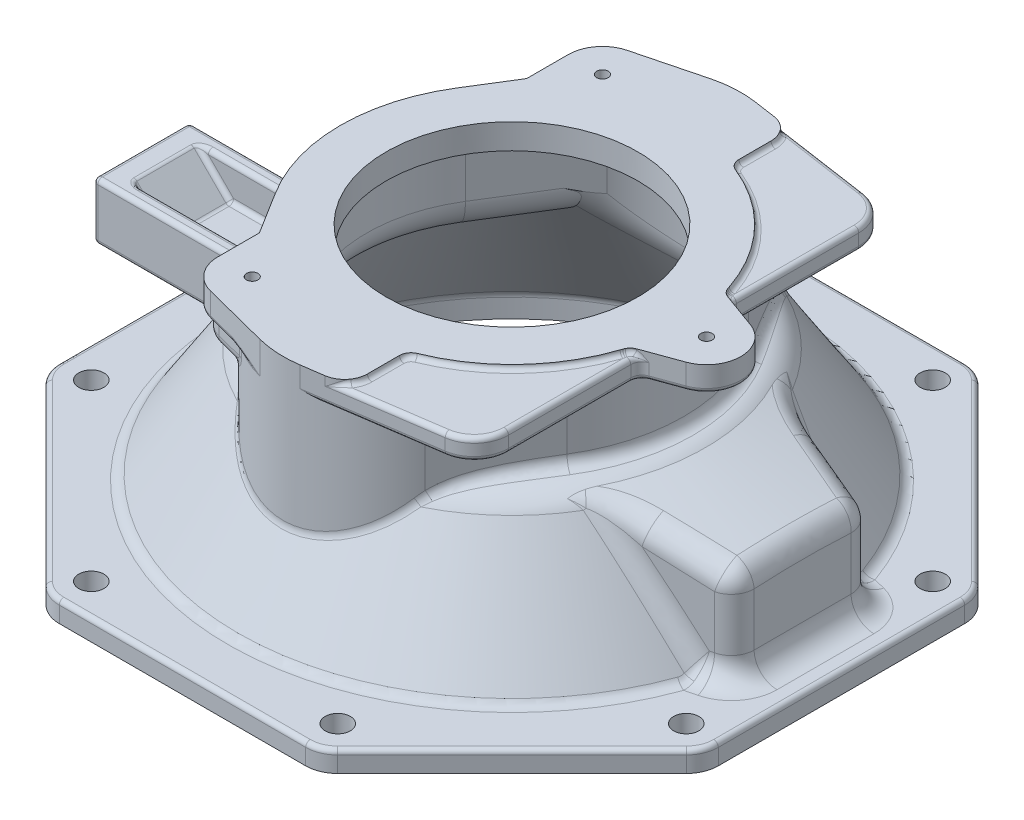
SolidWorks part; units mm, degrees
ref_plane "Plan de face" through (0, 0, 0) normal (0, 0, 1) x (1, 0, 0)
ref_plane "Plan de dessus" through (0, 0, 0) normal (0, 1, 0) x (1, 0, 0)
ref_plane "Plan de droite" through (0, 0, 0) normal (1, 0, 0) x (0, 0, -1)
sketch "Esquisse1" plane through (0, 0, 0) normal (0, 0, 1) x (1, 0, 0)
  line L0 (0, 71.5) -> (0, 81.5)
  line L1 (0, 81.5) -> (85, 81.5)
  line L2 (85, 81.5) -> (129, 12.5)
  line L3 (129, 12.5) -> (129, 0)
  line L4 (129, 0) -> (117, 0)
  line L5 (117, 0) -> (117, 12.7193)
  line L6 (117, 12.7193) -> (79.5166, 71.5)
  line L7 (79.5166, 71.5) -> (0, 71.5)
  dimension "D1" = 81.5
  dimension "D2" = 10
  dimension "D3" = 10
  dimension "D4" = 129
  dimension "D5" = 117
  dimension "D6" = 12.5
  dimension "D7" = 85
revolve "Révolution1" add sketch "Esquisse1" angle 360 about L0
ref_plane "Plan1" through (0, 12.5, 0) normal (0, -1, 0) x (1, 0, 0)
sketch "Esquisse2" plane through (0, 12.5, 0) normal (0, -1, 0) x (1, 0, 0)
  line L0 (-59.6468, 144) -> (59.6468, 144)
  line L1 (-59.6468, -144) -> (59.6468, -144)
  line L2 (144, 59.6468) -> (144, -59.6468)
  line L3 (-144, 59.6468) -> (-144, -59.6468)
  line L4 (-59.6468, 144) -> (-144, 59.6468)
  line L5 (-144, -59.6468) -> (-59.6468, -144)
  line L6 (59.6468, -144) -> (144, -59.6468)
  line L7 (59.6468, 144) -> (144, 59.6468)
  circle A0 centre (0, 0) radius 144 construction
  circle A2 centre (0, 0) radius 117 construction
  circle A3 centre (0, 0) radius 117
  dimension "D1" = 288
  dimension "D2" = 45
  dimension "D3" = 45
  dimension "D4" = 45
  dimension "D5" = 45
extrude "Boss.-Extru.1" add sketch "Esquisse2" against normal blind 12
sketch "Esquisse3" plane through (0, 81.5, 0) normal (0, 1, 0) x (1, 0, 0)
  line L0 (0, 0) -> (48.7796, 0) construction
  line L1 (39.9057, 77.8302) -> (63.6792, 39.6226)
  line L2 (39.9057, -77.8302) -> (63.6792, -39.6226)
  line L3 (0, 0) -> (0, 29.6462) construction
  line L4 (-39.9057, 77.8302) -> (-63.6792, 39.6226)
  line L5 (-39.9057, -77.8302) -> (-63.6792, -39.6226)
  arc A0 (-63.6792, 39.6226) -> (-63.6792, -39.6226) centre (0, 0) ccw
  arc A1 (39.9057, 77.8302) -> (-39.9057, 77.8302) centre (0, 53) ccw
  arc A2 (39.9057, -77.8302) -> (-39.9057, -77.8302) centre (0, -53) cw
  arc A3 (63.6792, -39.6226) -> (63.6792, 39.6226) centre (0, 0) ccw
  dimension "D1" = 150
  dimension "D2" = 94
  dimension "D3" = 53
extrude "Boss.-Extru.2" add sketch "Esquisse3" along normal blind 29 and the other way up to next
sketch "Esquisse6" plane through (0, 71.5, 0) normal (0, -1, 0) x (1, 0, 0)
  line L16 (32.783, 67.5094) -> (30.1415, 71.7547)
  line L17 (53.9151, 33.5472) -> (32.783, 67.5094)
  line L18 (32.783, -67.5094) -> (53.9151, -33.5472)
  line L19 (30.1415, -71.7547) -> (32.783, -67.5094)
  line L20 (-32.783, -67.5094) -> (-30.1415, -71.7547)
  line L21 (-53.9151, -33.5472) -> (-32.783, -67.5094)
  line L22 (-32.783, 67.5094) -> (-53.9151, 33.5472)
  line L23 (-30.1415, 71.7547) -> (-32.783, 67.5094)
  line L24 (32.783, 67.5094) -> (30.1415, 71.7547)
  line L25 (53.9151, 33.5472) -> (32.783, 67.5094)
  line L26 (32.783, -67.5094) -> (53.9151, -33.5472)
  line L27 (30.1415, -71.7547) -> (32.783, -67.5094)
  line L28 (-32.783, -67.5094) -> (-30.1415, -71.7547)
  line L29 (-53.9151, -33.5472) -> (-32.783, -67.5094)
  line L30 (-32.783, 67.5094) -> (-53.9151, 33.5472)
  line L31 (-30.1415, 71.7547) -> (-32.783, 67.5094)
  arc A8 (53.9151, -33.5472) -> (53.9151, 33.5472) centre (0, 0) ccw
  arc A9 (-30.1415, -71.7547) -> (30.1415, -71.7547) centre (0, -53) ccw
  arc A10 (-53.9151, 33.5472) -> (-53.9151, -33.5472) centre (0, 0) ccw
  arc A11 (30.1415, 71.7547) -> (-30.1415, 71.7547) centre (0, 53) ccw
  arc A12 (53.9151, -33.5472) -> (53.9151, 33.5472) centre (0, 0) ccw
  arc A13 (-30.1415, -71.7547) -> (30.1415, -71.7547) centre (0, -53) ccw
  arc A14 (-53.9151, 33.5472) -> (-53.9151, -33.5472) centre (0, 0) ccw
  arc A15 (30.1415, 71.7547) -> (-30.1415, 71.7547) centre (0, 53) ccw
  dimension "D1" = 11.5
extrude "Enlèv. mat.-Extru.1" cut sketch "Esquisse6" against normal blind 39 and the other way up to next
fillet "Congé2" radius 15 2 edges
fillet "Congé9" radius 5 12 edges at (3.7957, 58.1049, 99.8465) (-44.2153, 79.8774, 70.904) (-45.2998, 80.2905, -69.161) (-3.7957, 58.1049, -99.8465) (44.2153, 79.8774, -70.904) (59.3437, 81.5, -46.5905) (45.2998, 80.2905, 69.161)
fillet "Congé10" radius 5 1 edges at (0, 24.5, -121.3478)
fillet "Congé11" radius 14 8 edges at (-144, 18.5, 59.6468) (-144, 18.5, -59.6468) (-59.6468, 18.5, -144) (59.6468, 18.5, -144) (144, 18.5, -59.6468) (-59.6468, 18.5, 144) (59.6468, 18.5, 144) (144, 18.5, 59.6468)
fillet "Congé6" radius 15 8 edges at (42.0283, 71.5, -52.6509) (-1.42, 57.4391, -88.4716) (-42.0283, 71.5, -52.6509) (1.42, 57.4391, 88.4716) (63.5, 71.5, 0) (42.0283, 71.5, 52.6509) (-42.0283, 71.5, 52.6509) (-63.5, 71.5, 0)
fillet "Congé12" radius 2 16 edges at (59.2053, 24.5, -142.9343) (0, 24.5, -144) (-59.2053, 24.5, -142.9343) (-101.8234, 24.5, -101.8234) (-142.9343, 24.5, -59.2053) (-144, 24.5, 0) (-142.9343, 24.5, 59.2053) (-101.8234, 24.5, 101.8234) (-59.2053, 24.5, 142.9343) (0, 24.5, 144) (59.2053, 24.5, 142.9343) (101.8234, 24.5, 101.8234) (142.9343, 24.5, 59.2053) (144, 24.5, 0) (142.9343, 24.5, -59.2053) (101.8234, 24.5, -101.8234)
fillet "Congé22" radius 2 2 edges at (129, 0, 0) (0, 12.5, -129)
ref_plane "Plan2" through (127, 0, 0) normal (1, 0, 0) x (0, 0, -1)
sketch "Esquisse11" plane through (127, 0, 0) normal (1, 0, 0) x (0, 0, -1)
  line L0 (0, 0) -> (0, 38.6917) construction
  line L1 (-29, 79.3037) -> (29, 79.3037)
  line L2 (-29, 79.3037) -> (-29, 24.5)
  line L3 (-29, 24.5) -> (29, 24.5)
  line L4 (29, 79.3037) -> (29, 24.5)
  line L6 (62.333, 24.5) -> (138.4853, 24.5) construction
  line L9 (41.8382, 81.3037) -> (-41.8382, 81.3037) construction
  dimension "D1" = 58
  dimension "D2" = 2
extrude "Boss.-Extru.5" add sketch "Esquisse11" against normal up to next
draft "Dépouille5" type of draft neutral plane draft angle 14 faces to draft 2 parameters "D1"=14
sketch "Esquisse13" plane through (0, 0, 0) normal (0, 0, 1) x (1, 0, 0)
  line L1 (73.1855, 79.3037) -> (127, 79.3037) construction
  line L2 (84.5894, 79.3037) -> (137, 79.3037)
  line L3 (137, 79.3037) -> (137, 62.2745)
  line L4 (84.5894, 79.3037) -> (137, 62.2745)
  line L5 (127, 79.3037) -> (127, 24.5) construction
  dimension "D1" = 18
  dimension "D2" = 10
revolve "Enlèvement de matière-Révolution2" cut sketch "Esquisse13" angle 30 about axis through (0, 110.5, 0) along (0, -1, 0)
sketch "Esquisse14" plane through (0, 0, 0) normal (0, 0, 1) x (1, 0, 0)
  line L0 (117, 12.7193) -> (117, 59.3209)
  line L1 (117, 59.3209) -> (79.5166, 71.5)
  line L2 (79.5166, 71.5) -> (62.3385, 71.5)
  line L3 (127, 65.5237) -> (84.5894, 79.3037) construction
  line L4 (117, 12.7193) -> (103.9816, 12.5)
  line L5 (139.8995, 12.5) -> (63.7473, 12.5) construction
  line L6 (103.9816, 12.5) -> (62.3385, 71.5)
  line L7 (59.9549, 71.5) -> (79.5166, 71.5) construction
extrude "Enlèv. mat.-Extru.6" cut sketch "Esquisse14" against normal mid plane 38
draft "Dépouille8" type of draft neutral plane draft angle 14 faces to draft 2 parameters "D1"=14
fillet "Congé13" radius 5 6 edges at (63.3029, 71.5, 46.8524) (42.9158, 73.5125, 65.4117) (34.9143, 82.5589, 65.0817) (70.5254, 71.5, 36.7297)
fillet "Congé14" radius 5 6 edges at (70.5254, 71.5, -36.7297) (63.3029, 71.5, -46.8524) (-1.622, 53.7503, -90.8208) (44.8692, 72.8809, -64.5785) (34.906, 82.7228, -65.0125)
fillet "Congé17" radius 5 1 edges at (-117, 12.7193, 0)
fillet "Congé16" radius 5 1 edges at (117, 59.3209, 0)
fillet "Congé15" radius 5 6 edges at (96.5309, 65.9717, -19) (96.5309, 65.9717, 19) (117, 34.2037, 24.9559) (117, 34.2037, -24.9559) (116.0451, 58.6271, -19.2381) (116.0451, 58.6271, 19.2381)
fillet "Congé18" radius 5 10 edges at (76.8305, 71.0253, -18.4361) (112.7443, 12.8024, -30.3443) (77.103, 70.8689, 18.5066) (112.866, 12.2391, 30.4574)
fillet "Congé25" radius 10 11 edges at (76.3279, 77.5264, 41.634) (116.7138, 25.6438, 31.5646) (123.6177, 24.5, 29.8433) (123.6177, 24.5, -29.8433) (116.8583, 25.54, -31.5286) (127, 44.4808, -29) (127, 44.4808, 29) (127, 24.5, 0)
fillet "Congé26" radius 10 9 edges at (82.9918, 76.8497, -40.0318) (124.9789, 65.2287, -27.2152) (125.0033, 65.2232, 27.1828)
sketch "Esquisse8" plane through (0, 110.5, 0) normal (0, 1, 0) x (1, 0, 0)
  line L0 (-52, 76.5245) -> (-52, 58.3929)
  line L1 (-11.7082, 98.5183) -> (-40.7367, 91.0516)
  line L2 (75, 76.5245) -> (75, -76.5245)
  line L3 (6.835, 99.5003) -> (62.1814, 91.365)
  line L4 (0, 0) -> (29.0154, 0) construction
  line L5 (6.835, -99.5003) -> (62.1814, -91.365)
  line L6 (-11.7082, -98.5183) -> (-40.7367, -91.0516)
  line L7 (-52, -76.5245) -> (-52, -58.3929)
  line L8 (-39.9057, 77.8302) -> (-63.6792, 39.6226) construction
  line L9 (-52, 58.3929) -> (-63.6792, 39.6226)
  line L10 (-63.6792, -39.6226) -> (-39.9057, -77.8302) construction
  line L11 (-63.6792, -39.6226) -> (-52, -58.3929)
  arc A0 (75, -76.5245) -> (62.1814, -91.365) centre (60, -76.5245) cw
  arc A1 (-63.6792, 39.6226) -> (-63.6792, -39.6226) centre (0, 0) ccw construction
  arc A2 (-63.6792, 39.6226) -> (-63.6792, -39.6226) centre (0, 0) ccw
  arc A3 (6.835, 99.5003) -> (-11.7082, 98.5183) centre (0, 53) ccw
  arc A4 (-40.7367, 91.0516) -> (-52, 76.5245) centre (-37, 76.5245) ccw
  arc A5 (75, 76.5245) -> (62.1814, 91.365) centre (60, 76.5245) ccw
  arc A6 (6.835, -99.5003) -> (-11.7082, -98.5183) centre (0, -53) cw
  arc A7 (-40.7367, -91.0516) -> (-52, -76.5245) centre (-37, -76.5245) cw
  arc A8 (39.9057, 77.8302) -> (-39.9057, 77.8302) centre (0, 53) ccw construction
  point P15 (-52, 0)
  point P27 (75, 0)
  dimension "D1" = 15
  dimension "D4" = 15
  dimension "D2" = 85
  dimension "D3" = 75
  dimension "D5" = 52
extrude "Boss.-Extru.3" add sketch "Esquisse8" along normal blind 14
fillet "Congé29" radius 5 8 edges at (-42.0283, 110.5, 52.6509) (0, 110.5, 88.5) (42.0283, 110.5, 52.6509) (63.5, 110.5, 0) (42.0283, 110.5, -52.6509) (0, 110.5, -88.5) (-42.0283, 110.5, -52.6509) (-63.5, 110.5, 0)
sketch "Esquisse9" plane through (0, 110.5, 0) normal (0, -1, 0) x (-1, 0, 0)
  line L2 (-75, -76.5245) -> (-75, 76.5245) construction
  line L3 (-75, -19.6024) -> (-75, 19.6024)
  line L4 (0, 0) -> (115.1649, 0) construction
  line L5 (-75, 19.6024) -> (-90.1303, 14.0954)
  line L6 (-75, -19.6024) -> (-90.1303, -14.0954)
  arc A1 (-90.1303, 14.0954) -> (-90.1303, -14.0954) centre (-85, 0) ccw
  dimension "D2" = 85
  dimension "D1" = 15
  dimension "D3" = 20
extrude "Boss.-Extru.4" add sketch "Esquisse9" against normal up to surface (14 mm away)
sketch "Esquisse7" plane through (0, 124.5, 0) normal (0, 1, 0) x (1, 0, 0)
  circle A0 centre (0, 0) radius 52
  dimension "D1" = 104
extrude "Enlèv. mat.-Extru.3" cut sketch "Esquisse7" against normal up to next
sketch "Esquisse15" plane through (0, 124.5, 0) normal (0, 1, 0) x (1, 0, 0)
  line L0 (25, -74.162) -> (25, -96.8303)
  line L1 (90.1303, -14.0954) -> (75, -19.6024) construction
  line L2 (75, -19.6024) -> (74.4451, -19.8043)
  line L3 (75, -76.5245) -> (75, -19.6024) construction
  line L4 (6.835, -99.5003) -> (62.1814, -91.365) construction
  line L5 (75, -76.5245) -> (75, -19.6024)
  line L6 (25, -96.8303) -> (62.1814, -91.365)
  arc A0 (-63.6792, 39.6226) -> (-63.6792, -39.6226) centre (0, 0) ccw construction
  arc A1 (28.125, -69.5269) -> (71.3955, -22.9714) centre (0, 0) ccw
  arc A2 (62.1814, -91.365) -> (75, -76.5245) centre (60, -76.5245) ccw construction
  arc A3 (62.1814, -91.365) -> (75, -76.5245) centre (60, -76.5245) ccw
  arc A4 (74.4451, -19.8043) -> (71.3955, -22.9714) centre (76.1552, -24.5028) ccw
  arc A5 (28.125, -69.5269) -> (25, -74.162) centre (30, -74.162) ccw
  dimension "D2" = 5
  dimension "D3" = 5
  dimension "D1" = 25
extrude "Enlèv. mat.-Extru.7" cut sketch "Esquisse15" against normal blind 5
mirror "Symétrie1" about plane through (0, 0, 0) normal (0, 0, 1) of "Enlèv. mat.-Extru.7"
fillet "Congé27" radius 10 2 edges at (25, 122, -96.8303) (25, 122, 96.8303)
fillet "Congé28" radius 5 2 edges at (75, 115, -19.6024) (75, 115, 19.6024)
sketch "Esquisse16" plane through (0, 124.5, 0) normal (0, 1, 0) x (1, 0, 0)
  line L0 (-49, 63.2143) -> (-39.9057, 77.8302)
  line L2 (-39.9893, 88.1462) -> (-26.9627, 91.4969)
  line L3 (-49, 76.5245) -> (-49, 63.2143)
  line L4 (-52, 76.5245) -> (-52, 58.3929) construction
  line L5 (-11.7082, 98.5183) -> (-40.7367, 91.0516) construction
  line L7 (-39.9057, 77.8302) -> (-63.6792, 39.6226) construction
  arc A0 (-39.9893, 88.1462) -> (-49, 76.5245) centre (-37, 76.5245) ccw
  arc A1 (-40.7367, 91.0516) -> (-52, 76.5245) centre (-37, 76.5245) ccw construction
  arc A2 (-11.7082, 98.5183) -> (-39.9057, 77.8302) centre (0, 53) ccw construction
  arc A3 (-26.9627, 91.4969) -> (-39.9057, 77.8302) centre (0, 53) ccw
  dimension "D1" = 24
extrude "Boss.-Extru.6" add sketch "Esquisse16" against normal blind 26
mirror "Symétrie2" about plane through (0, 0, 0) normal (0, 0, 1) of "Boss.-Extru.6"
fillet "Congé31" radius 5 6 edges at (-33.476, 98.5, -89.8216) (-49, 98.5, -69.8694) (-46.4835, 98.5, -83.8773) (-33.476, 98.5, 89.8216) (-49, 98.5, 69.8694) (-46.4835, 98.5, 83.8773)
fillet "Congé32" radius 5 12 edges at (-49, 107, -63.2143) (-47.5355, 99.9645, -65.5679) (-41.9528, 98.5, -74.5401) (-37.6484, 98.5, -81.1353) (-28.1291, 101.2663, -90.653) (-26.9627, 107, -91.4969) (-49, 107, 63.2143) (-47.5355, 99.9645, 65.5679) (-41.9528, 98.5, 74.5401) (-37.6484, 98.5, 81.1353) (-27.4277, 102.0876, 91.167) (-26.9627, 107, 91.4969)
fillet "Congé34" radius 3 14 edges at (-27.0147, 110.5, -91.5585) (-33.9042, 110.5, -89.7114) (-49.1924, 110.5, -63.2693) (-49, 110.5, -70.5837) (-46.4835, 110.5, -83.8773) (-27.0147, 110.5, 91.5585) (-33.9042, 110.5, 89.7114) (-49.1924, 110.5, 63.2693) (-49, 110.5, 70.5837) (-46.4835, 110.5, 83.8773)
fillet "Congé35" radius 2 68 edges at (-48.8543, 110.5, 85.7155) (71.3517, 110.5, 86.3296) (75, 110.5, 49.814) (71.3517, 110.5, -86.3296) (-48.8543, 110.5, -85.7155) (-75, 124.5, 0) (-57.8396, 124.5, 49.0077) (-52, 124.5, 67.4587) (-48.8543, 124.5, 85.7155) (-26.2224, 124.5, 94.785) (-2.4856, 124.5, 99.9342) (11.6447, 124.5, 98.7934) (-2.4856, 124.5, -99.9342) (-26.2224, 124.5, -94.785) (-48.8543, 124.5, -85.7155) (-52, 124.5, -67.4587) (-57.8396, 124.5, -49.0077) (100, 110.5, 0) (84.2101, 110.5, 16.2502) (100, 124.5, 0) (82.2877, 124.5, 16.9499) (82.2877, 124.5, -16.9499) (76.3675, 119.5, 19.1046) (75, 119.5, 49.814) (71.3517, 119.5, 86.3296) (39.3178, 119.5, 94.7257) (72.5535, 124.5, 21.0347) (54.9357, 124.5, 51.0594) (25.8542, 124.5, 71.3669) (25, 124.5, 81.1774) (72.5535, 124.5, -21.0347) (54.9357, 124.5, -51.0594) (25.8542, 124.5, -71.3669) (25, 124.5, -81.1774) (39.3178, 119.5, -94.7257) (71.3517, 119.5, -86.3296) (75, 119.5, -49.814) (76.3675, 119.5, -19.1046) (11.6447, 124.5, -98.7934) (22.5678, 124.5, 94.7295) (22.5678, 124.5, -94.7295) (75, 110.5, -49.814) (84.2101, 110.5, -16.2502) (75.9042, 110.5, -20.2355) (75.9042, 119.5, -20.2355) (75.9042, 110.5, 20.2355) (75.9042, 119.5, 20.2355) (-35.0833, 106.519, 92.5058) (-52, 109.4916, 59.8248) (-17.3939, 108.9346, -97.0558) (-52, 109.4916, -59.8248)
fillet "Congé36" radius 2 12 edges at (76.2442, 118.7681, 19.1495) (20.6745, 119.248, 96.4268) (24.2465, 119.5, 92.0009) (25, 119.5, 81.1774) (25.8542, 119.5, 71.3669) (76.2442, 118.7681, -19.1495) (20.6745, 119.248, -96.4268) (24.2465, 119.5, -92.0009) (25, 119.5, -81.1774) (25.8542, 119.5, -71.3669) (54.9357, 119.5, 51.0594) (54.9357, 119.5, -51.0594)
ref_plane "Plan3" through (-162, 0, 0) normal (1, 0, 0) x (0, 0, -1)
sketch "Esquisse17" plane through (-162, 0, 0) normal (1, 0, 0) x (0, 0, -1)
  line L0 (14.5, 69) -> (14.5, 54)
  line L1 (21, 69) -> (14.5, 69)
  line L2 (21, 69) -> (21, 44)
  line L3 (21, 44) -> (-21, 44)
  line L4 (-21, 69) -> (-21, 44)
  line L5 (14.5, 54) -> (-14.5, 54)
  line L6 (-14.5, 54) -> (-14.5, 69)
  line L7 (-14.5, 69) -> (-21, 69)
  line L8 (-127, 0) -> (127, 0) construction
  line L9 (0, 0) -> (0, 31.0248) construction
  dimension "D1" = 44
  dimension "D2" = 10
  dimension "D3" = 6.5
  dimension "D4" = 25
  dimension "D5" = 42
extrude "Boss.-Extru.7" add sketch "Esquisse17" along normal up to next
sketch "Esquisse18" plane through (0, 0, -14.5) normal (0, 0, 1) x (1, 0, 0)
  line L0 (-162, 69) -> (-162, 54)
  line L1 (-162, 69) -> (-162, 44) construction
  line L2 (-162, 54) -> (-137, 54)
  line L3 (-101.5058, 54) -> (-162, 54) construction
  line L4 (-137, 54) -> (-152, 69)
  line L5 (-90.5683, 69) -> (-162, 69) construction
  line L6 (-152, 69) -> (-162, 69)
  dimension "D1" = 45
  dimension "D2" = 10
extrude "Boss.-Extru.8" add sketch "Esquisse18" along normal up to next
fillet "Congé37" radius 2 24 edges at (-121.9167, 69, -14.5) (-91.2587, 69, -17.7613) (-91.2587, 69, 17.7613) (-119.2529, 54, 14.5) (-121.9167, 69, 14.5) (-137, 54, 0) (-152, 69, 0) (-144.5, 61.5, -14.5) (-119.2529, 54, -14.5) (-102.5362, 54, 0) (-126.2841, 69, -21) (-126.2841, 69, 21) (-162, 69, 0) (-134.4347, 44, 21) (-162, 56.5, 21) (-162, 44, 0) (-162, 56.5, -21) (-134.4347, 44, -21) (-108.913, 44, 0) (-144.5, 61.5, 14.5)
fillet "Congé39" radius 2 16 edges at (-59.2053, 12.5, 142.9343) (0, 12.5, 144) (59.2053, 12.5, 142.9343) (101.8234, 12.5, 101.8234) (142.9343, 12.5, 59.2053) (144, 12.5, 0) (142.9343, 12.5, -59.2053) (101.8234, 12.5, -101.8234) (59.2053, 12.5, -142.9343) (0, 12.5, -144) (-59.2053, 12.5, -142.9343) (-101.8234, 12.5, -101.8234) (-142.9343, 12.5, -59.2053) (-144, 12.5, 0) (-142.9343, 12.5, 59.2053) (-101.8234, 12.5, 101.8234)
sketch "Esquisse20" plane through (0, 0, 0) normal (0, 0, 1) x (1, 0, 0)
  line L0 (138.4853, 12.5) -> (62.333, 12.5) construction
  line L1 (126, 12.5) -> (132, 12.5)
  line L2 (126, 12.5) -> (126, 0)
  line L3 (126, 0) -> (132, 0)
  line L4 (132, 12.5) -> (132, 0)
  line L5 (-127, 0) -> (127, 0) construction
  line L6 (129, 2) -> (129, 10.5) construction
  dimension "D1" = 3
  dimension "D2" = 3
revolve "Enlèvement de matière-Révolution3" cut sketch "Esquisse20" angle 360 about axis through (0, 110.5, 0) along (0, -1, 0)
sketch "Esquisse21" plane through (0, 0, 0) normal (0, -1, 0) x (1, 0, 0)
  circle A0 centre (0, 0) radius 126 construction
  circle A1 centre (0, 0) radius 126
extrude "Enlèv. mat.-Extru.8" cut sketch "Esquisse21" against normal blind 3
sketch "Esquisse22" plane through (0, 12.5, 0) normal (0, -1, 0) x (1, 0, 0)
  line L0 (-139.8995, 63.7473) -> (-63.7473, 139.8995) construction
  line L1 (-144, -53.8478) -> (-144, 53.8478) construction
  line L2 (-63.7473, -139.8995) -> (-139.8995, -63.7473) construction
  line L3 (53.8478, -144) -> (-53.8478, -144) construction
  line L4 (139.8995, -63.7473) -> (63.7473, -139.8995) construction
  line L5 (144, 53.8478) -> (144, -53.8478) construction
  line L6 (63.7473, 139.8995) -> (139.8995, 63.7473) construction
  line L7 (-53.8478, 144) -> (53.8478, 144) construction
  line L8 (-139.8995, 63.7473) -> (-63.7473, 139.8995)
  line L9 (-144, -53.8478) -> (-144, 53.8478)
  line L10 (-63.7473, -139.8995) -> (-139.8995, -63.7473)
  line L11 (53.8478, -144) -> (-53.8478, -144)
  line L12 (139.8995, -63.7473) -> (63.7473, -139.8995)
  line L13 (144, 53.8478) -> (144, -53.8478)
  line L14 (63.7473, 139.8995) -> (139.8995, 63.7473)
  line L15 (-53.8478, 144) -> (53.8478, 144)
  arc A0 (-53.8478, 144) -> (-63.7473, 139.8995) centre (-53.8478, 130) ccw construction
  arc A1 (-139.8995, 63.7473) -> (-144, 53.8478) centre (-130, 53.8478) ccw construction
  arc A2 (-144, -53.8478) -> (-139.8995, -63.7473) centre (-130, -53.8478) ccw construction
  arc A3 (-63.7473, -139.8995) -> (-53.8478, -144) centre (-53.8478, -130) ccw construction
  arc A4 (53.8478, -144) -> (63.7473, -139.8995) centre (53.8478, -130) ccw construction
  arc A5 (139.8995, -63.7473) -> (144, -53.8478) centre (130, -53.8478) ccw construction
  arc A6 (144, 53.8478) -> (139.8995, 63.7473) centre (130, 53.8478) ccw construction
  arc A7 (63.7473, 139.8995) -> (53.8478, 144) centre (53.8478, 130) ccw construction
  arc A8 (-53.8478, 144) -> (-63.7473, 139.8995) centre (-53.8478, 130) ccw
  arc A9 (-139.8995, 63.7473) -> (-144, 53.8478) centre (-130, 53.8478) ccw
  arc A10 (-144, -53.8478) -> (-139.8995, -63.7473) centre (-130, -53.8478) ccw
  arc A11 (-63.7473, -139.8995) -> (-53.8478, -144) centre (-53.8478, -130) ccw
  arc A12 (53.8478, -144) -> (63.7473, -139.8995) centre (53.8478, -130) ccw
  arc A13 (139.8995, -63.7473) -> (144, -53.8478) centre (130, -53.8478) ccw
  arc A14 (144, 53.8478) -> (139.8995, 63.7473) centre (130, 53.8478) ccw
  arc A15 (63.7473, 139.8995) -> (53.8478, 144) centre (53.8478, 130) ccw
  circle A16 centre (0, 0) radius 126 construction
  circle A17 centre (0, 0) radius 126
extrude "Enlèv. mat.-Extru.9" cut sketch "Esquisse22" against normal blind 3
sketch "Esquisse23" plane through (0, 24.5, 0) normal (0, 1, 0) x (1, 0, 0)
  circle A0 centre (53.8478, 130) radius 5.5
  arc A1 (62.333, 138.4853) -> (53.8478, 142) centre (53.8478, 130) ccw construction
  dimension "D1" = 11
extrude "Enlèv. mat.-Extru.10" cut sketch "Esquisse23" against normal through all
pattern_circular "Répétition circulaire1" count 8 over 360 about axis through (0, 0, 0) along (0, 1, 0) of "Enlèv. mat.-Extru.10"
sketch "Esquisse24" plane through (0, 124.5, 0) normal (0, 1, 0) x (1, 0, 0)
  line L1 (-101.3266, 108.8351) -> (105.7618, 108.8351)
  line L2 (-101.3266, 108.8351) -> (-101.3266, -117.9945)
  line L3 (-101.3266, -117.9945) -> (105.7618, -117.9945)
  line L4 (105.7618, 108.8351) -> (105.7618, -117.9945)
extrude "Enlèv. mat.-Extru.11" cut sketch "Esquisse24" against normal blind 3
hole_wizard "Trou taraudé M61" positions "Esquisse26" profile "Esquisse25" tap size "M6" standard "ISO"
sketch "Esquisse26" plane through (0, 121.5, 0) normal (0, 1, 0) x (-1, 0, 0)
  arc A0 (40.7367, -91.0516) -> (52, -76.5245) centre (37, -76.5245) ccw construction
  point P0 (37, -76.5245)
sketch "Esquisse25" plane through (-37, 121.5, -76.5245) normal (1, 0, 0) x (0, 0, 1)
  line L0 (0, 0) -> (0, 18.5022)
  line L1 (0, 18.5022) -> (2.5, 17)
  line L2 (2.5, 17) -> (2.5, 0)
  line L5 (2.5, 0) -> (0, 0)
  line L10 (0, 18.5022) -> (-2.5, 17) construction
  line L11 (0, -6.35) -> (0, 107.95) construction
  dimension "Diamètre du trou pour taraudage" = 5
  dimension "Profondeur du trou pour taraudage" = 17
  dimension "Angle de pointe" = 118
hole_wizard "Trou taraudé M62" positions "Esquisse28" profile "Esquisse27" tap size "M6" standard "ISO"
sketch "Esquisse28" plane through (0, 121.5, 0) normal (0, 1, 0) x (-1, 0, 0)
  arc A0 (52, 76.5245) -> (40.7367, 91.0516) centre (37, 76.5245) ccw construction
  point P0 (37, 76.5245)
sketch "Esquisse27" plane through (-37, 121.5, 76.5245) normal (1, 0, 0) x (0, 0, 1)
  line L0 (0, 0) -> (0, 18.5022)
  line L1 (0, 18.5022) -> (2.5, 17)
  line L2 (2.5, 17) -> (2.5, 0)
  line L5 (2.5, 0) -> (0, 0)
  line L10 (0, 18.5022) -> (-2.5, 17) construction
  line L11 (0, -6.35) -> (0, 107.95) construction
  dimension "Diamètre du trou pour taraudage" = 5
  dimension "Profondeur du trou pour taraudage" = 17
  dimension "Angle de pointe" = 118
hole_wizard "Trou taraudé M65" positions "Esquisse36" profile "Esquisse35" tap size "M6" standard "ISO"
sketch "Esquisse36" plane through (0, 121.5, 0) normal (0, 1, 0) x (-1, 0, 0)
  arc A0 (-90.1303, 14.0954) -> (-90.1303, -14.0954) centre (-85, 0) ccw construction
  point P0 (-85, 0)
sketch "Esquisse35" plane through (85, 121.5, 0) normal (1, 0, 0) x (0, 0, 1)
  line L0 (0, 0) -> (0, 18.5022)
  line L1 (0, 18.5022) -> (2.5, 17)
  line L2 (2.5, 17) -> (2.5, 0)
  line L5 (2.5, 0) -> (0, 0)
  line L10 (0, 18.5022) -> (-2.5, 17) construction
  line L11 (0, -6.35) -> (0, 107.95) construction
  dimension "Diamètre du trou pour taraudage" = 5
  dimension "Profondeur du trou pour taraudage" = 17
  dimension "Angle de pointe" = 118
sketch "Esquisse37" plane through (0, 121.5, 0) normal (0, 1, 0) x (1, 0, 0)
  circle A2 centre (0, 0) radius 55
  circle A3 centre (0, 0) radius 55
  dimension "D1" = 3
extrude "Enlèv. mat.-Extru.12" cut sketch "Esquisse37" against normal up to next
chamfer "Chanfrein1" distance 2 angle 45 1 edges at (126, 3, 0)
